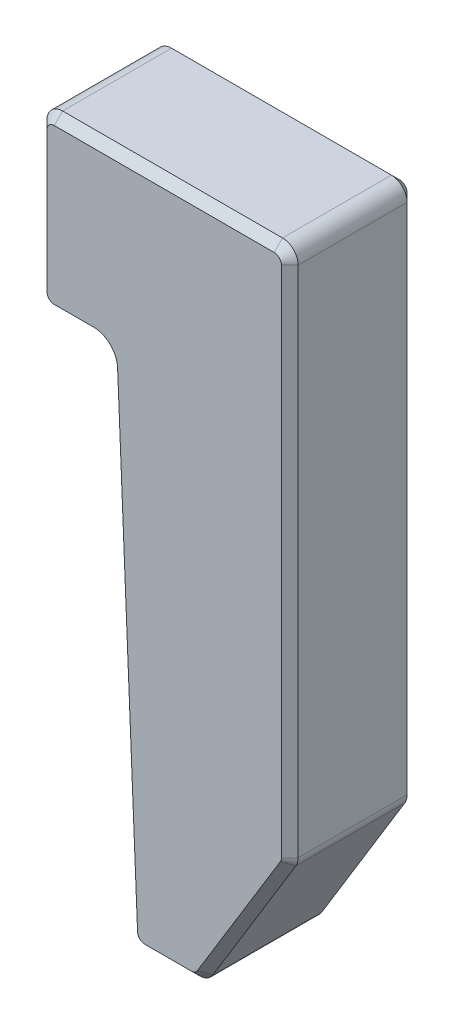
SolidWorks part; units mm, degrees
ref_plane "Спереди" through (0, 0, 0) normal (0, 0, 1) x (1, 0, 0)
ref_plane "Сверху" through (0, 0, 0) normal (0, 1, 0) x (1, 0, 0)
ref_plane "Справа" through (0, 0, 0) normal (1, 0, 0) x (0, 0, -1)
sketch "Эскиз1" plane through (0, 0, 0) normal (0, 0, 1) x (1, 0, 0)
  line L0 (-0.015, 0.3594) -> (-0.4921, 11.7906)
  line L1 (-0.8668, 12.15) -> (-1.805, 12.15)
  line L2 (-2.18, 12.525) -> (-2.18, 15.875)
  line L3 (-1.805, 16.25) -> (3.445, 16.25)
  line L4 (3.82, 15.875) -> (3.82, 3.6195)
  line L5 (3.7651, 3.4241) -> (1.7846, 0.1796)
  line L6 (1.4646, 0) -> (0.3597, 0)
  arc A0 (3.82, 3.6195) -> (3.7651, 3.4241) centre (3.445, 3.6195) cw
  arc A1 (1.7846, 0.1796) -> (1.4646, 0) centre (1.4646, 0.375) cw
  arc A2 (-0.015, 0.3594) -> (0.3597, 0) centre (0.3597, 0.375) ccw
  arc A3 (3.445, 16.25) -> (3.82, 15.875) centre (3.445, 15.875) cw
  arc A4 (-2.18, 15.875) -> (-1.805, 16.25) centre (-1.805, 15.875) cw
  arc A5 (-1.805, 12.15) -> (-2.18, 12.525) centre (-1.805, 12.525) cw
  arc A6 (-0.4921, 11.7906) -> (-0.8668, 12.15) centre (-0.8668, 11.775) ccw
  point P10 (3.82, 3.5141)
  point P13 (1.675, 0)
  point P16 (0, 0)
  dimension "D8" = 0.375
  dimension "D1" = 2.39
  dimension "D2" = 3.82
  dimension "D3" = 31.4
  dimension "D4" = 1.675
  dimension "D5" = 16.25
  dimension "D6" = 4.1
  dimension "D7" = 6
extrude "Бобышка-Вытянуть1" add sketch "Эскиз1" along normal blind 3
chamfer "Фаска1" distance 0.2 angle 45 28 edges at (-0.6072, 12.0456, 0) (-0.2536, 6.075, 0) (-1.3359, 12.15, 0) (0.1001, 0.1044, 0) (-2.0702, 12.2598, 0) (0.9121, 0, 0) (-2.18, 14.2, 0) (1.6481, 0.048, 0) (-2.0702, 16.1402, 0) (2.7749, 1.8019, 0) (0.82, 16.25, 0) (3.806, 3.518, 0) (3.7102, 16.1402, 0) (3.82, 9.7472, 0) (-0.6072, 12.0456, 3) (-0.2536, 6.075, 3) (-1.3359, 12.15, 3) (0.1001, 0.1044, 3) (-2.0702, 12.2598, 3) (0.9121, 0, 3) (-2.18, 14.2, 3) (1.6481, 0.048, 3) (-2.0702, 16.1402, 3) (2.7749, 1.8019, 3) (0.82, 16.25, 3) (3.806, 3.518, 3) (3.7102, 16.1402, 3) (3.82, 9.7472, 3)
